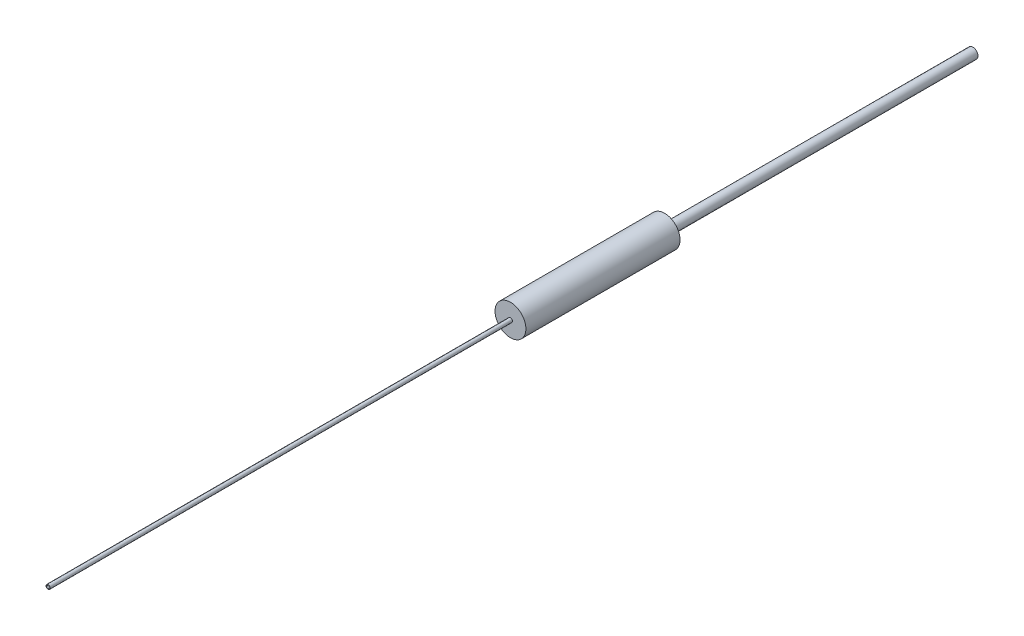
SolidWorks part; units mm, degrees
ref_plane "前视基准面" through (0, 0, 0) normal (0, 0, 1) x (1, 0, 0)
ref_plane "上视基准面" through (0, 0, 0) normal (0, 1, 0) x (1, 0, 0)
ref_plane "右视基准面" through (0, 0, 0) normal (1, 0, 0) x (0, 0, -1)
sketch "草图1" plane through (0, 0, 0) normal (0, 0, 1) x (1, 0, 0)
  circle A0 centre (0, 0) radius 1.5
  dimension "D1" = 3
extrude "凸台-拉伸1" add sketch "草图1" against normal blind 15
sketch "草图2" plane through (0, 0, 0) normal (0, 0, 1) x (1, 0, 0)
  circle A0 centre (0, 0) radius 0.2
  dimension "D1" = 0.4
extrude "凸台-拉伸2" add sketch "草图2" along normal blind 45
sketch "草图3" plane through (0, 0, -15) normal (0, 0, -1) x (-1, 0, 0)
  circle A0 centre (0, 0) radius 0.5
  dimension "D1" = 1
extrude "凸台-拉伸3" add sketch "草图3" along normal blind 30
sketch "草图4" plane through (0, 0, 45) normal (0, 0, 1) x (1, 0, 0)
  circle A0 centre (0, 0) radius 0.1375
  circle A1 centre (0, 0) radius 0.1325
  dimension "D1" = 0.275
  dimension "D2" = 0.265
extrude "切除-拉伸1" cut sketch "草图4" against normal blind 0.1
